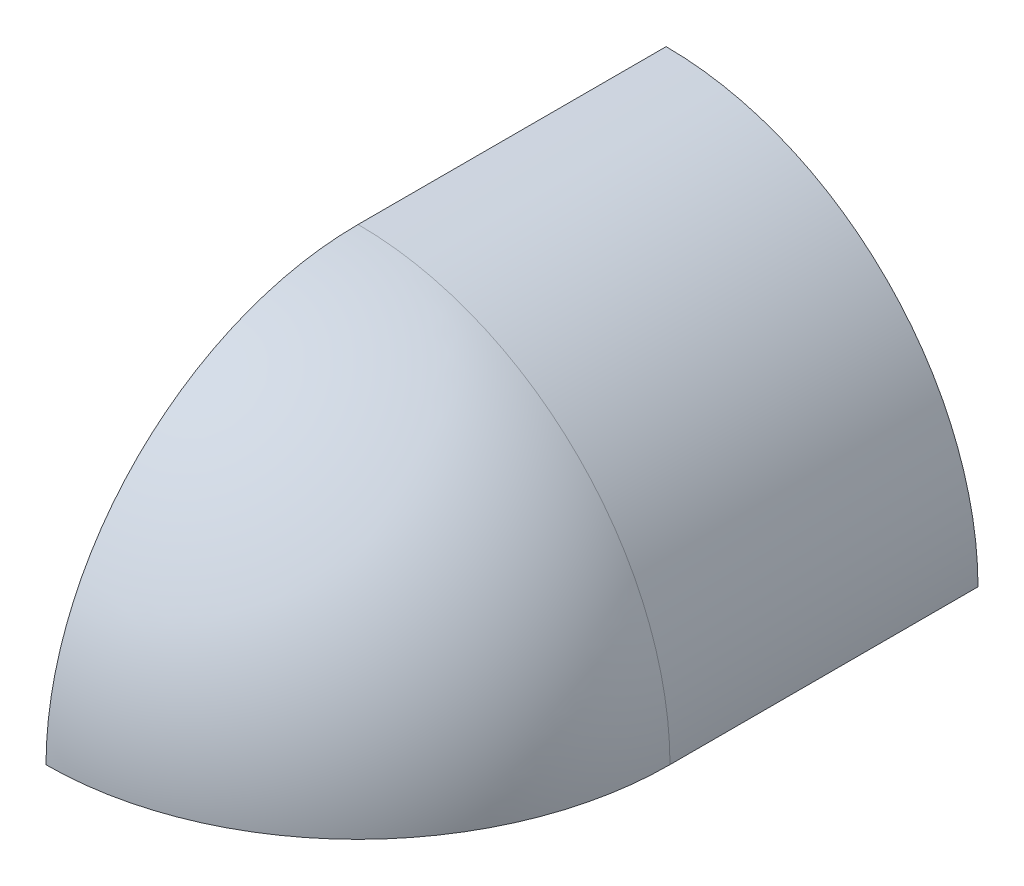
SolidWorks part; units mm, degrees
ref_plane "前视基准面" through (0, 0, 0) normal (0, 0, 1) x (1, 0, 0)
ref_plane "上视基准面" through (0, 0, 0) normal (0, 1, 0) x (1, 0, 0)
ref_plane "右视基准面" through (0, 0, 0) normal (1, 0, 0) x (0, 0, -1)
sketch "草图1" plane through (0, 0, 0) normal (1, 0, 0) x (0, 0, -1)
  line L0 (-51.0811, 0) -> (61.0403, 0) construction
  line L1 (-40.1581, 0) -> (41.2847, 0)
  line L2 (0.8318, 40.9612) -> (41.2847, 40.9612)
  line L3 (41.2847, 40.9612) -> (41.2847, 0)
  arc A1 (0.8318, 40.9612) -> (-40.1581, 0) centre (0.8032, 0) ccw
revolve "旋转1" add sketch "草图1" angle 90 about L0
